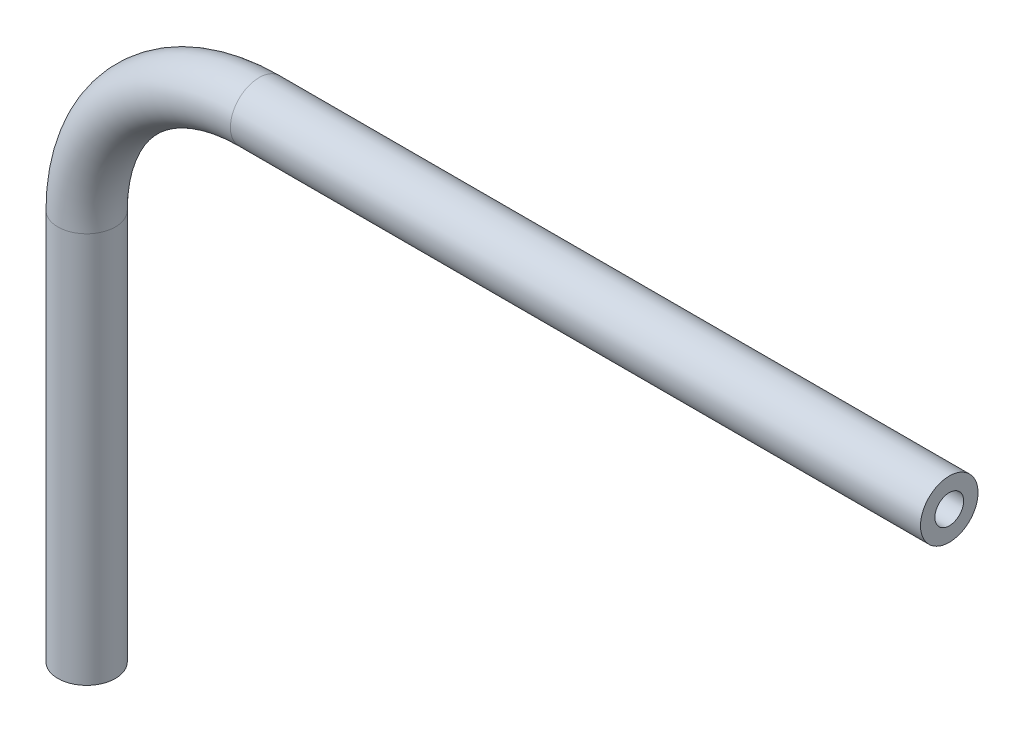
SolidWorks part; units mm, degrees
ref_plane "Front Plane" through (0, 0, 0) normal (0, 0, 1) x (1, 0, 0)
ref_plane "Top Plane" through (0, 0, 0) normal (0, 1, 0) x (1, 0, 0)
ref_plane "Right Plane" through (0, 0, 0) normal (1, 0, 0) x (0, 0, -1)
sketch "Sketch1" plane through (0, 0, 0) normal (0, 0, 1) x (1, 0, 0)
  line L0 (0, 0) -> (0, 21.59)
  line L1 (9.525, 31.115) -> (47.625, 31.115)
  arc A0 (0, 21.59) -> (9.525, 31.115) centre (9.525, 21.59) cw
  dimension "D1" = 9.525
  dimension "D2" = 21.59
  dimension "D3" = 38.1
sketch "Sketch2" plane through (0, 0, 0) normal (0, 1, 0) x (1, 0, 0)
  circle A0 centre (0, 0) radius 1.5875
  circle A1 centre (0, 0) radius 0.7938
  dimension "D1" = 1.5875
  dimension "D2" = 3.175
sweep "Sweep1" add profiles "Sketch2" path "Sketch1"
